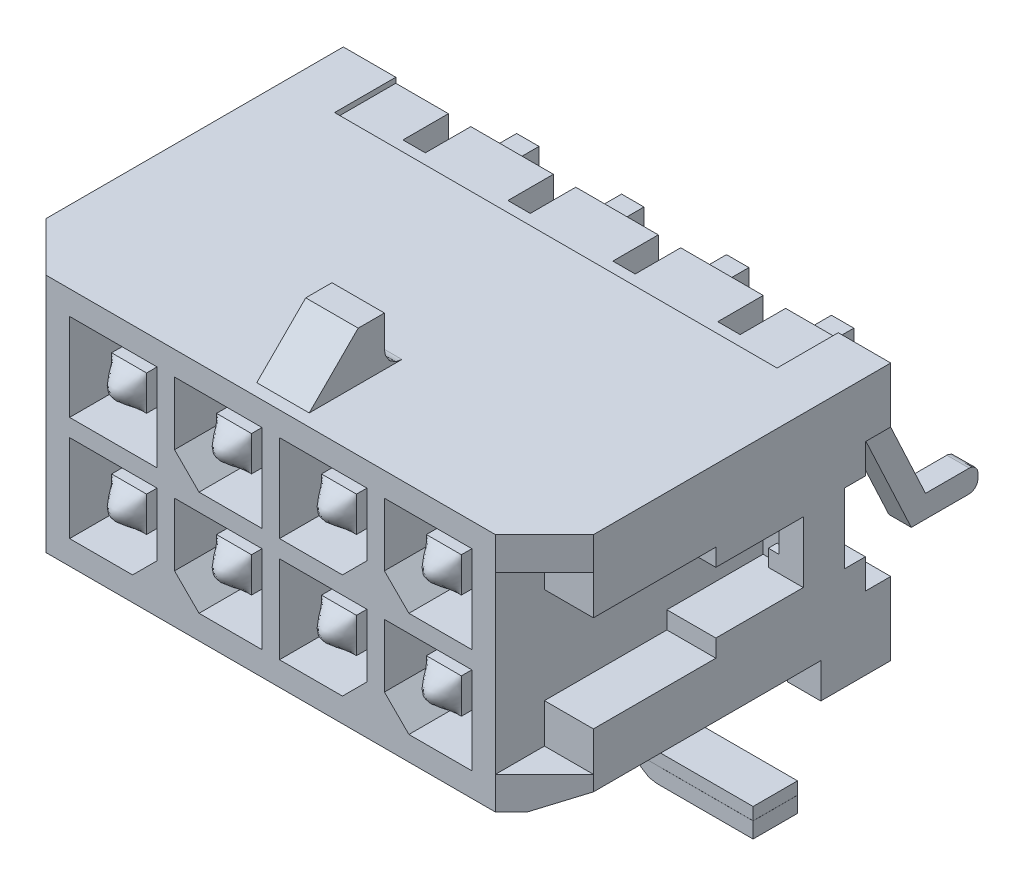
SolidWorks part; units mm, degrees
ref_plane "Plane1" through (0, 0, 0) normal (0, 0, 1) x (1, 0, 0)
ref_plane "Plane2" through (0, 0, 0) normal (0, 1, 0) x (1, 0, 0)
ref_plane "Plane3" through (0, 0, 0) normal (1, 0, 0) x (0, 0, -1)
imported_body "Surface-Imported1"
imported_body "Surface-Imported2"
imported_body "Surface-Imported3"
imported_body "Surface-Imported4"
imported_body "Surface-Imported5"
sketch "Sketch5" plane through (0, 0, 0) normal (0, 0, 1) x (1, 0, 0)
  line L0 (-5.75, 0.25) -> (-5.75, 2.75) construction
  line L1 (-5, 2) -> (5, 2)
  line L2 (-5, 2) -> (-5, -2.1)
  line L3 (-5, -2.1) -> (5, -2.1)
  line L4 (5, 2) -> (5, -2.1)
  line L5 (-5.75, 2.75) -> (-3.25, 2.75) construction
  dimension "D3" = 0.75
  dimension "D4" = 0.75
extrude "Base-Extrude" add sketch "Sketch5" along normal blind 0.5
sketch "Sketch6" plane through (0, 0, 0.5) normal (0, 0, 1) x (1, 0, 0)
  line L0 (-2, 2) -> (-2, 1)
  line L1 (-5, 2) -> (-4, 2)
  line L2 (-5, 2) -> (-5, 1)
  line L3 (-5, 1) -> (-4, 1)
  line L4 (-4, 2) -> (-4, 1)
  line L5 (-2, 2) -> (-1, 2)
  line L6 (-1, 2) -> (-1, 1)
  line L7 (-2, 1) -> (-1, 1)
  line L8 (1, 2) -> (1, 1)
  line L9 (1, 2) -> (2, 2)
  line L10 (2, 2) -> (2, 1)
  line L11 (1, 1) -> (2, 1)
  line L12 (4, 2) -> (4, 1)
  line L13 (4, 2) -> (5, 2)
  line L14 (5, 2) -> (5, 1)
  line L15 (4, 1) -> (5, 1)
  line L16 (-5, -1) -> (-5, -2)
  line L17 (-5, -1) -> (-4, -1)
  line L18 (-4, -1) -> (-4, -2)
  line L19 (-5, -2) -> (-4, -2)
  line L20 (-2, -1) -> (-2, -2)
  line L21 (-2, -1) -> (-1, -1)
  line L22 (-1, -1) -> (-1, -2)
  line L23 (-2, -2) -> (-1, -2)
  line L24 (1, -1) -> (1, -2)
  line L25 (1, -1) -> (2, -1)
  line L26 (2, -1) -> (2, -2)
  line L27 (1, -2) -> (2, -2)
  line L28 (4, -1) -> (4, -2)
  line L29 (4, -1) -> (5, -1)
  line L30 (5, -1) -> (5, -2)
  line L31 (4, -2) -> (5, -2)
extrude "Boss-Extrude3" add sketch "Sketch6" along normal blind 4
dome "Dome1" faces to dome 2 distance 0.5 parameters "D1"=0.5
dome "Dome2" faces to dome 2 distance 0.5 parameters "D1"=0.5
dome "Dome3" faces to dome 2 distance 0.5 parameters "D1"=0.5
dome "Dome4" faces to dome 2 distance 0.5 parameters "D1"=0.5
dome "Dome5" faces to dome 2 distance 0.5 parameters "D1"=0.5
dome "Dome6" faces to dome 2 distance 0.5 parameters "D1"=0.5
dome "Dome7" faces to dome 2 distance 0.5 parameters "D1"=0.5
dome "Dome8" faces to dome 2 distance 0.5 parameters "D1"=0.5
sketch "Sketch8" plane through (0, 0, 0.985) normal (0, 0, 1) x (1, 0, 0)
  line L0 (-9.8391, -3.9326) -> (-6.825, -3.9326)
  line L1 (-9.8391, -3.5778) -> (-6.9754, -3.5778)
  line L2 (-9.8391, -3.5778) -> (-9.8391, -3.9326)
  line L4 (-6.425, -2.5) -> (-6.425, -3.435) construction
  line L5 (-6.425, -3.0165) -> (-6.425, -3.5326)
  line L6 (-6.876, -3.0165) -> (-6.8754, -3.4777)
  line L8 (6.425, -3.0165) -> (6.425, -3.5326)
  line L10 (6.8751, -3.0165) -> (6.8751, -3.4778)
  line L11 (9.825, -3.9326) -> (9.825, -3.5778)
  line L12 (6.825, -3.9326) -> (9.825, -3.9326)
  line L13 (6.9751, -3.5778) -> (9.825, -3.5778)
  line L14 (6.8751, -3.0165) -> (6.425, -3.0165)
  line L15 (-6.425, -3.0165) -> (-6.876, -3.0165)
  arc A0 (6.425, -3.5326) -> (6.825, -3.9326) centre (6.825, -3.5326) ccw
  arc A1 (-6.425, -3.5326) -> (-6.825, -3.9326) centre (-6.825, -3.5326) cw
  arc A2 (6.8751, -3.4778) -> (6.9751, -3.5778) centre (6.9751, -3.4778) ccw
  arc A3 (-6.8754, -3.4777) -> (-6.9754, -3.5778) centre (-6.9754, -3.4778) cw
extrude "Boss-Extrude5" add sketch "Sketch8" against normal blind 1.27 separate body
